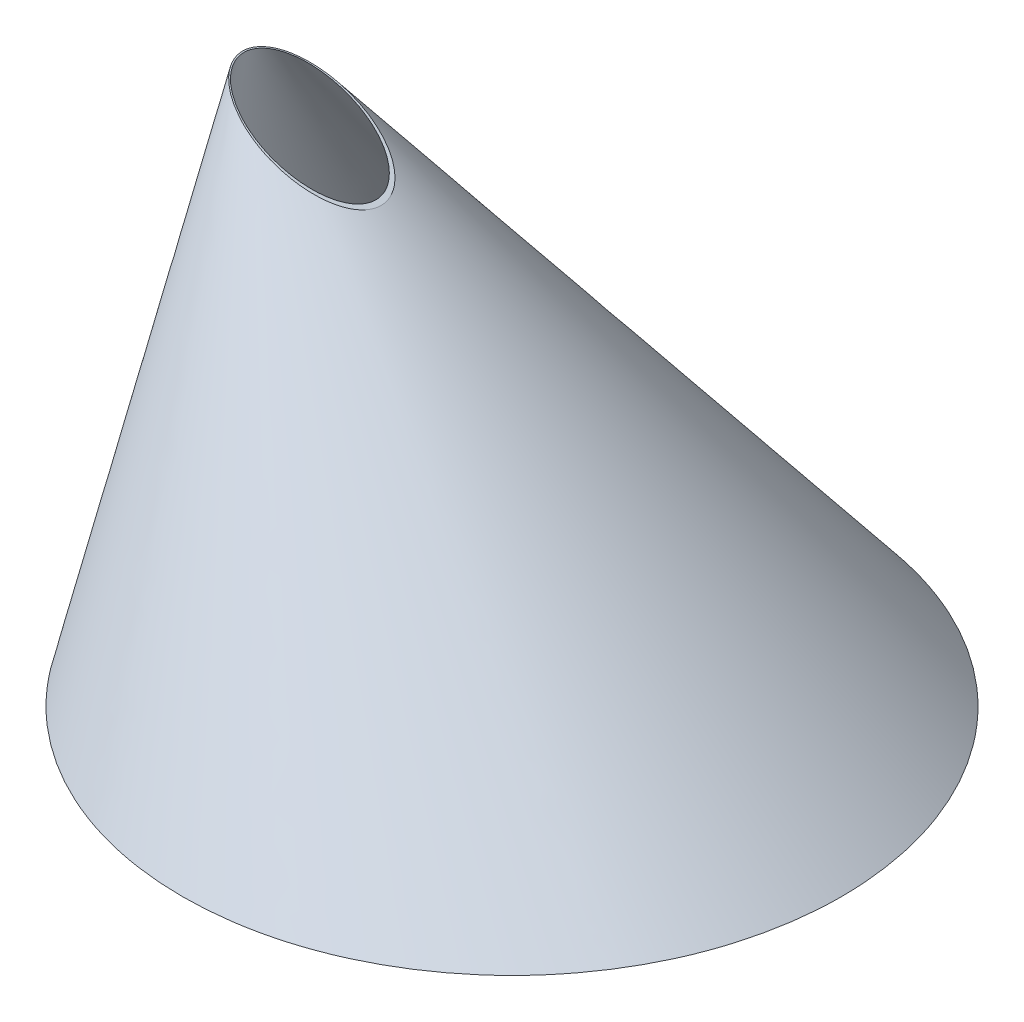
SolidWorks part; units mm, degrees
ref_plane "前视基准面" through (0, 0, 0) normal (0, 0, 1) x (1, 0, 0)
ref_plane "上视基准面" through (0, 0, 0) normal (0, 1, 0) x (1, 0, 0)
ref_plane "右视基准面" through (0, 0, 0) normal (1, 0, 0) x (0, 0, -1)
sketch "草图1" plane through (0, 0, 0) normal (0, 1, 0) x (1, 0, 0)
  line L0 (-250, 0) -> (250, 0) construction
  circle A0 centre (0, 0) radius 250
  dimension "D" = 500
sketch "草图2" plane through (0, 0, 0) normal (0, 0, 1) x (1, 0, 0)
  line L0 (-250, 0) -> (-200, 360) construction
  line L1 (-200, 360) -> (250, 0) construction
  line L2 (-204.3808, 328.4582) -> (500, 0)
  line L3 (500, 0) -> (0, 0) construction
  dimension "H" = 360
  dimension "C" = 200
  dimension "φ" = 25
  dimension "S" = 500
sketch "草图3" plane through (0, 0, 0) normal (0, 0, 1) x (1, 0, 0)
  point P0 (-200, 360)
loft "放样1" add profiles "草图1", "草图3"
extrude "切除-拉伸1" cut sketch "草图2" against normal through all and the other way through all
shell "抽壳1"
